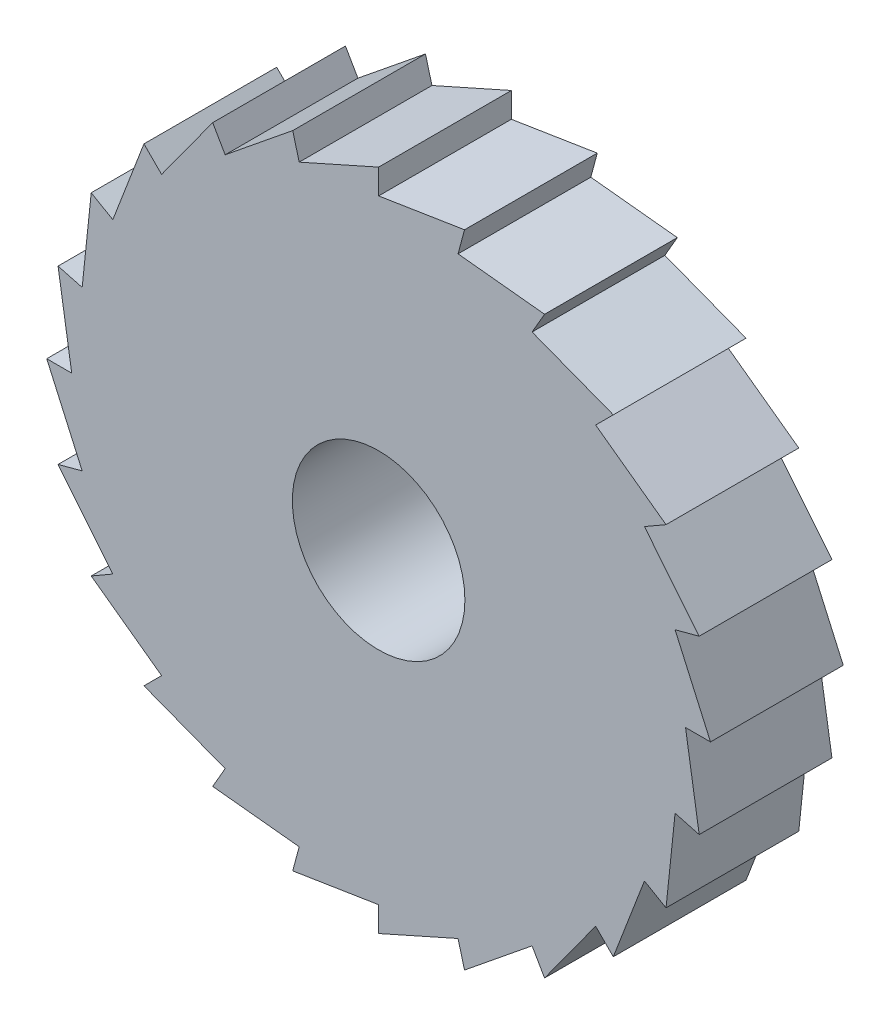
SolidWorks part; units mm, degrees
ref_plane "Front Plane" through (0, 0, 0) normal (0, 0, 1) x (1, 0, 0)
ref_plane "Top Plane" through (0, 0, 0) normal (0, 1, 0) x (1, 0, 0)
ref_plane "Right Plane" through (0, 0, 0) normal (1, 0, 0) x (0, 0, -1)
sketch "Sketch1" plane through (0, 0, 0) normal (0, 0, 1) x (1, 0, 0)
  line L0 (0, 23.12) -> (0, 25)
  line L1 (5.9839, 22.3322) -> (6.4705, 24.1481)
  line L2 (0, 23.12) -> (6.4705, 24.1481)
  line L3 (5.9839, 22.3322) -> (12.5, 21.6506)
  line L4 (11.56, 20.0225) -> (12.5, 21.6506)
  line L5 (11.56, 20.0225) -> (17.6777, 17.6777)
  line L6 (16.3483, 16.3483) -> (17.6777, 17.6777)
  line L7 (16.3483, 16.3483) -> (21.6506, 12.5)
  line L8 (20.0225, 11.56) -> (21.6506, 12.5)
  line L9 (20.0225, 11.56) -> (24.1481, 6.4705)
  line L10 (22.3322, 5.9839) -> (24.1481, 6.4705)
  line L11 (22.3322, 5.9839) -> (25, 0)
  line L12 (23.12, 0) -> (25, 0)
  line L13 (23.12, 0) -> (24.1481, -6.4705)
  line L14 (22.3322, -5.9839) -> (24.1481, -6.4705)
  line L15 (22.3322, -5.9839) -> (21.6506, -12.5)
  line L16 (20.0225, -11.56) -> (21.6506, -12.5)
  line L17 (20.0225, -11.56) -> (17.6777, -17.6777)
  line L18 (16.3483, -16.3483) -> (17.6777, -17.6777)
  line L19 (16.3483, -16.3483) -> (12.5, -21.6506)
  line L20 (11.56, -20.0225) -> (12.5, -21.6506)
  line L21 (11.56, -20.0225) -> (6.4705, -24.1481)
  line L22 (5.9839, -22.3322) -> (6.4705, -24.1481)
  line L23 (5.9839, -22.3322) -> (0, -25)
  line L24 (0, -23.12) -> (0, -25)
  line L25 (0, -23.12) -> (-6.4705, -24.1481)
  line L26 (-5.9839, -22.3322) -> (-6.4705, -24.1481)
  line L27 (-5.9839, -22.3322) -> (-12.5, -21.6506)
  line L28 (-11.56, -20.0225) -> (-12.5, -21.6506)
  line L29 (-11.56, -20.0225) -> (-17.6777, -17.6777)
  line L30 (-16.3483, -16.3483) -> (-17.6777, -17.6777)
  line L31 (-16.3483, -16.3483) -> (-21.6506, -12.5)
  line L32 (-20.0225, -11.56) -> (-21.6506, -12.5)
  line L33 (-20.0225, -11.56) -> (-24.1481, -6.4705)
  line L34 (-22.3322, -5.9839) -> (-24.1481, -6.4705)
  line L35 (-22.3322, -5.9839) -> (-25, 0)
  line L36 (-23.12, 0) -> (-25, 0)
  line L37 (-23.12, 0) -> (-24.1481, 6.4705)
  line L38 (-22.3322, 5.9839) -> (-24.1481, 6.4705)
  line L39 (-22.3322, 5.9839) -> (-21.6506, 12.5)
  line L40 (-20.0225, 11.56) -> (-21.6506, 12.5)
  line L41 (-20.0225, 11.56) -> (-17.6777, 17.6777)
  line L42 (-16.3483, 16.3483) -> (-17.6777, 17.6777)
  line L43 (-16.3483, 16.3483) -> (-12.5, 21.6506)
  line L44 (-11.56, 20.0225) -> (-12.5, 21.6506)
  line L45 (-11.56, 20.0225) -> (-6.4705, 24.1481)
  line L46 (-5.9839, 22.3322) -> (-6.4705, 24.1481)
  line L47 (-5.9839, 22.3322) -> (0, 25)
  line L48 (0, 23.12) -> (0, 25)
  point P81 (0, 0)
  dimension "D2" = 15
  dimension "D4" = 24
extrude "Boss-Extrude1" add sketch "Sketch1" along normal blind 10 contours L47 L46 L45 L44 L43 L42 L41 L40 L39 L38 L37 L36 L35 L34 L33 L32 L31 L30 L29 L28 L27 L26 L25 L24 L23 L22 L21 L20 L19 L18 L17 L16 L15 L14 L13 L12 L11 L10 L9 L8 L7 L6 L5 L4 L3 L1 L2 L0
sketch "Sketch2" plane through (0, 0, 10) normal (0, 0, 1) x (1, 0, 0)
  circle A0 centre (0, 0) radius 6.5
  dimension "D1" = 13
extrude "Cut-Extrude1" cut sketch "Sketch2" against normal blind 10
